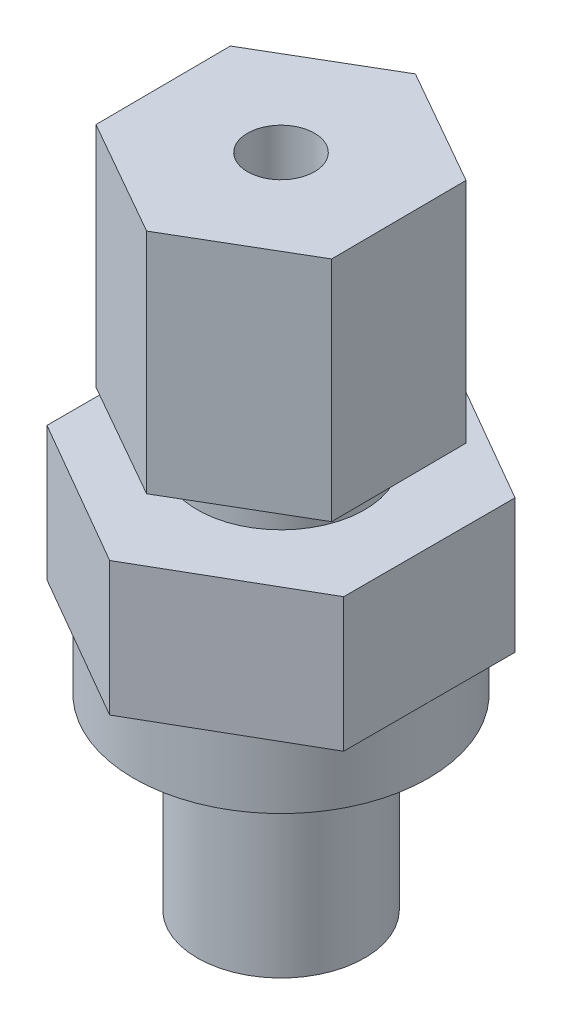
SolidWorks part; units mm, degrees
ref_plane "Front Plane" through (0, 0, 0) normal (0, 0, 1) x (1, 0, 0)
ref_plane "Top Plane" through (0, 0, 0) normal (0, 1, 0) x (1, 0, 0)
ref_plane "Right Plane" through (0, 0, 0) normal (1, 0, 0) x (0, 0, -1)
sketch "Sketch1" plane through (0, 0, 0) normal (0, 1, 0) x (1, 0, 0)
  circle A0 centre (0, 0) radius 3.9688
extrude "5/16-24_threads" add sketch "Sketch1" along normal blind 8.89
sketch "Sketch2" plane through (0, 8.89, 0) normal (0, 1, 0) x (1, 0, 0)
  circle A0 centre (0, 0) radius 6.985
extrude "oring_base" add sketch "Sketch2" along normal blind 3.175
sketch "Sketch3" plane through (0, 12.065, 0) normal (0, 1, 0) x (1, 0, 0)
  line L0 (0, -8.128) -> (0, 8.128) construction
  line L1 (0, 0) -> (7.0391, 4.064) construction
  line L2 (0, 0) -> (7.0391, -4.064) construction
  line L3 (7.0391, 4.064) -> (0, 8.128)
  line L4 (7.0391, 4.064) -> (7.0391, -4.064)
  line L5 (7.0391, -4.064) -> (0, -8.128)
  line L6 (-7.0391, -4.064) -> (0, -8.128)
  line L7 (-7.0391, 4.064) -> (-7.0391, -4.064)
  line L8 (-7.0391, 4.064) -> (0, 8.128)
  dimension "D1" = 60
extrude "9/16_hex" add sketch "Sketch3" along normal blind 6.35
sketch "Sketch4" plane through (0, 18.415, 0) normal (0, 1, 0) x (1, 0, 0)
  circle A0 centre (0, 0) radius 3.9688
extrude "tube" add sketch "Sketch4" along normal blind 9.525
sketch "Sketch5" plane through (0, 27.94, 0) normal (0, 1, 0) x (1, 0, 0)
  line L1 (5.5764, -3.1728) -> (5.5359, 3.2429)
  line L2 (5.5359, 3.2429) -> (-0.0404, 6.4157)
  line L3 (-0.0404, 6.4157) -> (-5.5764, 3.1728)
  line L4 (-5.5764, 3.1728) -> (-5.5359, -3.2429)
  line L5 (-5.5359, -3.2429) -> (0.0404, -6.4157)
  line L6 (0.0404, -6.4157) -> (5.5764, -3.1728)
  circle A0 centre (0, 0) radius 5.5563 construction
extrude "Extrude1" add sketch "Sketch5" along normal blind 3.175 and the other way blind 7.62
sketch "Sketch6" plane through (0, 31.115, 0) normal (0, 1, 0) x (1, 0, 0)
  circle A0 centre (0, 0) radius 1.5875
  dimension "D1" = 3.175
extrude "Cut-Extrude1" cut sketch "Sketch6" against normal blind 12.7
sketch "Sketch7" plane through (0, 0, 0) normal (0, -1, 0) x (1, 0, 0)
  circle A0 centre (0, 0) radius 1.1684
  dimension "D1" = 2.3368
extrude "Cut-Extrude2" cut sketch "Sketch7" against normal through all
